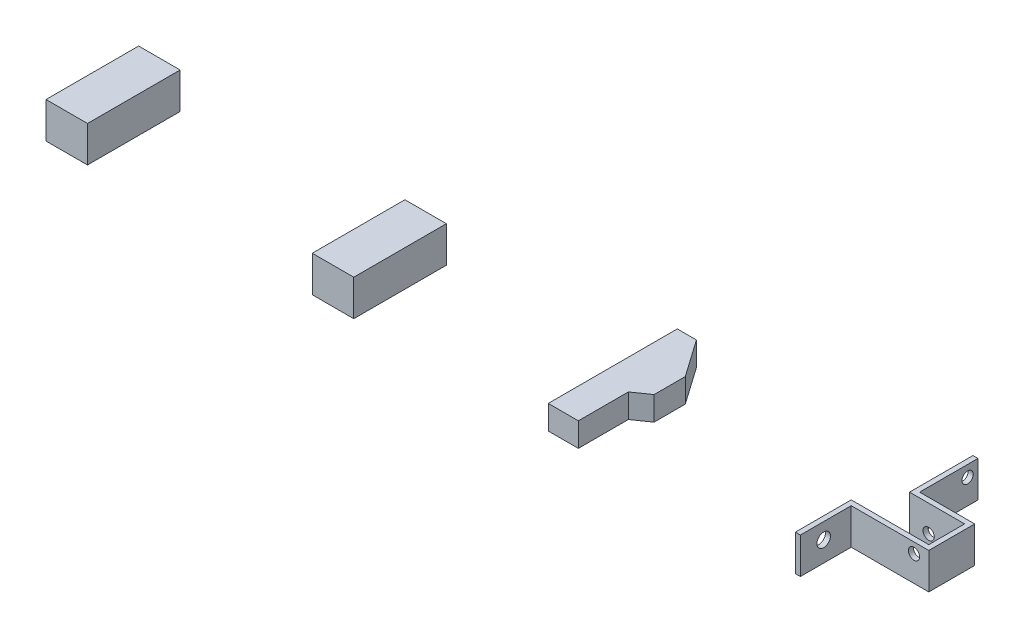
SolidWorks part; units mm, degrees
ref_plane "Front Plane" through (0, 0, 0) normal (0, 0, 1) x (1, 0, 0)
ref_plane "Top Plane" through (0, 0, 0) normal (0, 1, 0) x (1, 0, 0)
ref_plane "Right Plane" through (0, 0, 0) normal (1, 0, 0) x (0, 0, -1)
sketch "Sketch5" plane through (0, 0, 0) normal (0, 1, 0) x (1, 0, 0)
  line L0 (0, 0) -> (0, 104.8876)
  arc A0 (0, 104.8876) -> (56.5589, 161.4465) centre (56.5589, 104.8876) cw
sketch "Sketch6" plane through (0, 0, 0) normal (0, 0, 1) x (1, 0, 0)
  circle A0 centre (0, 0) radius 14.7527
sketch "Sketch8" plane through (0, 0, 0) normal (0, 1, 0) x (1, 0, 0)
  line L0 (398.1913, 0) -> (398.1913, 142.3168)
  line L1 (484.5417, 142.3168) -> (484.5417, 0)
  arc A0 (398.1913, 142.3168) -> (484.5417, 142.3168) centre (441.3665, 142.3168) cw
sketch "Sketch9" plane through (0, 0, 0) normal (0, 0, 1) x (1, 0, 0)
  circle A0 centre (371.0534, 0) radius 11.8818
sketch "Sketch10" plane through (0, 0, 0) normal (0, 1, 0) x (1, 0, 0)
  line L1 (843.963, 0) -> (948.8234, 0)
  line L2 (843.963, 0) -> (843.963, 234.1562)
  line L3 (843.963, 234.1562) -> (948.8234, 234.1562)
  line L4 (948.8234, 0) -> (948.8234, 234.1562)
extrude "Extrude2" add sketch "Sketch10" along normal blind 90.932
sketch "Sketch11" plane through (0, 0, 0) normal (0, 0, 1) x (1, 0, 0)
  circle A0 centre (948.8234, 90.932) radius 18.479
sketch "Sketch12" plane through (0, 0, 0) normal (0, 1, 0) x (1, 0, 0)
  line L0 (948.8234, 0) -> (948.8234, 234.1562) construction
  line L1 (1516.9476, 0) -> (1621.8079, 0)
  line L2 (1516.9476, 0) -> (1516.9476, 234.1562)
  line L3 (1516.9476, 234.1562) -> (1621.8079, 234.1562)
  line L4 (1621.8079, 0) -> (1621.8079, 234.1562)
  line L5 (843.963, 0) -> (948.8234, 0) construction
extrude "Extrude3" add sketch "Sketch12" along normal blind 90.932
sketch "Sketch13" plane through (0, 0, 0) normal (0, 0, 1) x (1, 0, 0)
  circle A0 centre (1621.8079, 90.932) radius 23.6692
  circle A1 centre (1516.9476, 90.932) radius 23.6692
  circle A2 centre (1516.9476, 0) radius 23.6692
  circle A3 centre (1621.8079, 0) radius 23.6692
sketch "Sketch14" plane through (0, 0, 0) normal (0, 1, 0) x (1, 0, 0)
  line L0 (2113.4317, 0) -> (2113.4317, 326.1476)
  line L1 (2113.4317, 326.1476) -> (2161.8045, 326.1476)
  line L2 (2161.8045, 326.1476) -> (2227.7801, 231.9825)
  line L3 (2227.7801, 231.9825) -> (2227.7801, 153.1424)
  line L4 (2227.7801, 153.1424) -> (2189.4926, 126.3168)
  line L5 (2189.4926, 126.3168) -> (2189.4926, 0)
  line L6 (2189.4926, 0) -> (2113.4317, 0)
extrude "Extrude4" add sketch "Sketch14" along normal blind 60.452
sketch "Sketch15" plane through (0, 0, 0) normal (0, 0, 1) x (1, 0, 0)
  line L1 (2113.4317, 60.452) -> (2123.4782, 60.452)
  line L2 (2113.4317, 60.452) -> (2113.4317, 67.9105)
  line L3 (2113.4317, 67.9105) -> (2123.4782, 67.9105)
  line L4 (2123.4782, 60.452) -> (2123.4782, 67.9105)
sketch "Sketch18" plane through (0, 0, 0) normal (0, 1, 0) x (1, 0, 0)
  line L0 (2737.9079, 0) -> (2737.9079, 141.2427)
  line L1 (2737.9079, 141.2427) -> (2933.9428, 141.2427)
  line L2 (2933.9428, 141.2427) -> (2933.9428, 231.9181)
  line L3 (2933.9428, 231.9181) -> (2794.7328, 231.9181)
  line L4 (2794.7328, 231.9181) -> (2794.7328, 392.2031)
extrude "Extrude-Thin1" add sketch "Sketch18" along normal blind 90.932 thin
sketch "Sketch19" plane through (2750.6079, 0, 0) normal (1, 0, 0) x (0, 0, -1)
  circle A0 centre (58.9251, 50.8777) radius 17.1517
extrude "Cut-Extrude1" cut sketch "Sketch19" against normal up to next (12.7 mm away)
sketch "Sketch20" plane through (0, 0, -128.5427) normal (0, 0, 1) x (1, 0, 0)
  circle A0 centre (2909.2689, 65.0382) radius 14.2659
extrude "Cut-Extrude2" cut sketch "Sketch20" against normal up to next (12.7 mm away)
sketch "Sketch21" plane through (71.6175, 14.702, -231.9181) normal (0, 0, 1) x (1, 0, 0)
  circle A0 centre (2771.345, 9.2473) radius 14.2659
extrude "Cut-Extrude3" cut sketch "Sketch21" against normal up to next (12.7 mm away)
sketch "Sketch22" plane through (2807.4328, -4.1986, 2466.245) normal (1, 0, 0) x (0, 0, -1)
  circle A0 centre (2832.237, 66.5891) radius 14.2659
extrude "Cut-Extrude4" cut sketch "Sketch22" against normal up to next (12.7 mm away)
sketch3d "3DSketch1"
  line L0 (2737.9079, 50.8777, -58.9251) -> (2750.6079, 50.8777, -58.9251) construction
  line L1 (2909.2689, 65.0382, -141.2427) -> (2909.2689, 65.0382, -128.5427) construction
  line L2 (2842.9626, 23.9494, -244.6181) -> (2842.9626, 23.9494, -231.9181) construction
  line L3 (2794.7328, 62.3905, -365.992) -> (2807.4328, 62.3905, -365.992) construction
  point P0 (2750.6079, 50.8777, -58.9251)
  point P1 (2909.2689, 65.0382, -128.5427)
  point P4 (2842.9626, 23.9494, -231.9181)
  point P7 (2807.4328, 62.3905, -365.992)
  point P10 (2737.9079, 50.8777, -58.9251)
  point P13 (2794.7328, 62.3905, -365.992)
curve "Curve2"
sketch "Sketch23" plane through (2737.9079, 0, 0) normal (-1, 0, 0) x (0, 0, 1)
  circle A0 centre (-58.9251, 50.8777) radius 2.8634
